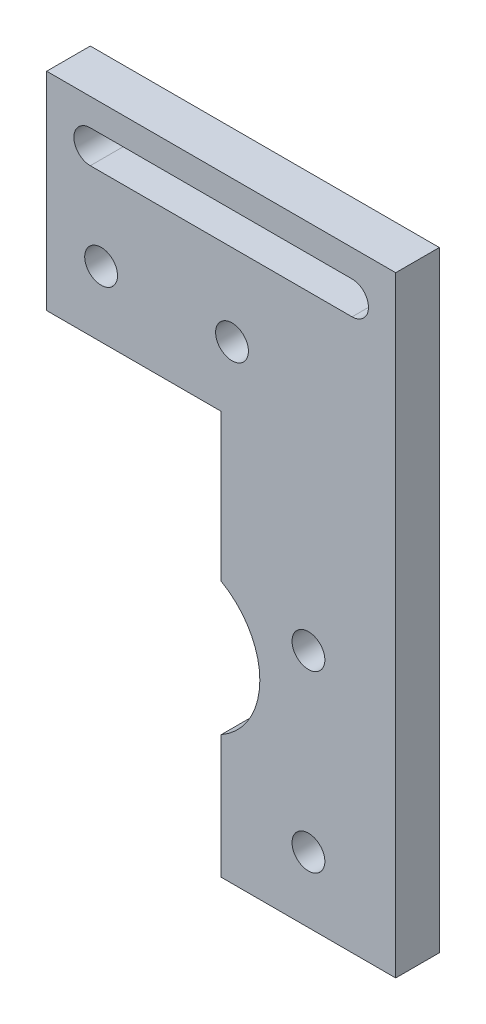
SolidWorks part; units mm, degrees
ref_plane "Front Plane" through (0, 0, 0) normal (0, 0, 1) x (1, 0, 0)
ref_plane "Top Plane" through (0, 0, 0) normal (0, 1, 0) x (1, 0, 0)
ref_plane "Right Plane" through (0, 0, 0) normal (1, 0, 0) x (0, 0, -1)
sketch "Sketch1" plane through (0, 0, 0) normal (0, 0, 1) x (1, 0, 0)
  line L0 (-12.7, -9.525) -> (12.7, -9.525)
  line L1 (12.7, -9.525) -> (12.7, 79.375)
  line L2 (12.7, 79.375) -> (-38.1, 79.375)
  line L3 (-38.1, 79.375) -> (-38.1, 49.1998)
  line L4 (-38.1, 49.1998) -> (-12.7, 49.1998)
  line L5 (-12.7, 49.1998) -> (-12.7, -9.525)
  line L6 (-31.75, 73.025) -> (6.35, 73.025) construction
  line L7 (-31.75, 75.4126) -> (6.35, 75.4126)
  line L8 (-31.75, 70.6374) -> (6.35, 70.6374)
  circle A0 centre (0, 0) radius 2.3876
  circle A1 centre (0, 25.4) radius 2.3876
  circle A2 centre (-18.1864, 18.1102) radius 11.1125
  circle A3 centre (-30.1752, 58.7502) radius 2.3876
  circle A4 centre (-11.1252, 58.7502) radius 2.3876
  arc A5 (-31.75, 75.4126) -> (-31.75, 70.6374) centre (-31.75, 73.025) ccw
  arc A6 (6.35, 70.6374) -> (6.35, 75.4126) centre (6.35, 73.025) ccw
  point P19 (-12.7, 73.025)
  dimension "D2" = 4.7752
  dimension "D11" = 22.225
  dimension "D13" = 4.7752
  dimension "D1" = 25.4
  dimension "D3" = 12.7
  dimension "D4" = 12.7
  dimension "D5" = 9.525
  dimension "D6" = 88.9
  dimension "D7" = 30.1752
  dimension "D8" = 50.8
  dimension "D9" = 7.2898
  dimension "D10" = 18.1864
  dimension "D12" = 20.6248
  dimension "D14" = 7.9248
  dimension "D15" = 19.05
  dimension "D16" = 6.35
  dimension "D17" = 6.35
  dimension "D18" = 4.7752
  dimension "D19" = 6.35
sketch "Sketch2" plane through (0, 0, 0) normal (0, 0, 1) x (1, 0, 0)
  line L0 (-12.7, -9.525) -> (12.7, -9.525) construction
  line L1 (12.7, -9.525) -> (12.7, 79.375) construction
  line L2 (12.7, 79.375) -> (-38.1, 79.375) construction
  line L3 (-38.1, 79.375) -> (-38.1, 49.1998) construction
  line L4 (-38.1, 49.1998) -> (-12.7, 49.1998) construction
  line L5 (-12.7, 49.1998) -> (-12.7, -9.525) construction
  line L6 (-12.7, -9.525) -> (12.7, -9.525)
  line L7 (12.7, -9.525) -> (12.7, 79.375)
  line L8 (12.7, 79.375) -> (-38.1, 79.375)
  line L9 (-38.1, 79.375) -> (-38.1, 49.1998)
  line L10 (-38.1, 49.1998) -> (-12.7, 49.1998)
  line L11 (-12.7, 49.1998) -> (-12.7, -9.525)
  line L12 (-31.75, 70.6374) -> (6.35, 70.6374) construction
  line L13 (-31.75, 75.4126) -> (6.35, 75.4126) construction
  line L14 (-31.75, 70.6374) -> (6.35, 70.6374)
  line L15 (-31.75, 75.4126) -> (6.35, 75.4126)
  circle A0 centre (0, 0) radius 2.3876 construction
  circle A1 centre (0, 25.4) radius 2.3876 construction
  circle A2 centre (0, 0) radius 2.3876
  circle A3 centre (0, 25.4) radius 2.3876
  circle A4 centre (-30.1752, 58.7502) radius 2.3876 construction
  circle A5 centre (-11.1252, 58.7502) radius 2.3876 construction
  circle A6 centre (-30.1752, 58.7502) radius 2.3876
  circle A7 centre (-11.1252, 58.7502) radius 2.3876
  arc A8 (6.35, 70.6374) -> (6.35, 75.4126) centre (6.35, 73.025) ccw construction
  arc A9 (-31.75, 75.4126) -> (-31.75, 70.6374) centre (-31.75, 73.025) ccw construction
  arc A10 (6.35, 70.6374) -> (6.35, 75.4126) centre (6.35, 73.025) ccw
  arc A11 (-31.75, 75.4126) -> (-31.75, 70.6374) centre (-31.75, 73.025) ccw
extrude "Boss-Extrude1" add sketch "Sketch2" along normal blind 6.35
sketch "Sketch3" plane through (0, 0, 0) normal (0, 0, 1) x (1, 0, 0)
  circle A0 centre (-18.1864, 18.1102) radius 11.1125 construction
  circle A1 centre (-18.1864, 18.1102) radius 11.1125
extrude "Cut-Extrude1" cut sketch "Sketch3" along normal blind 12.7
